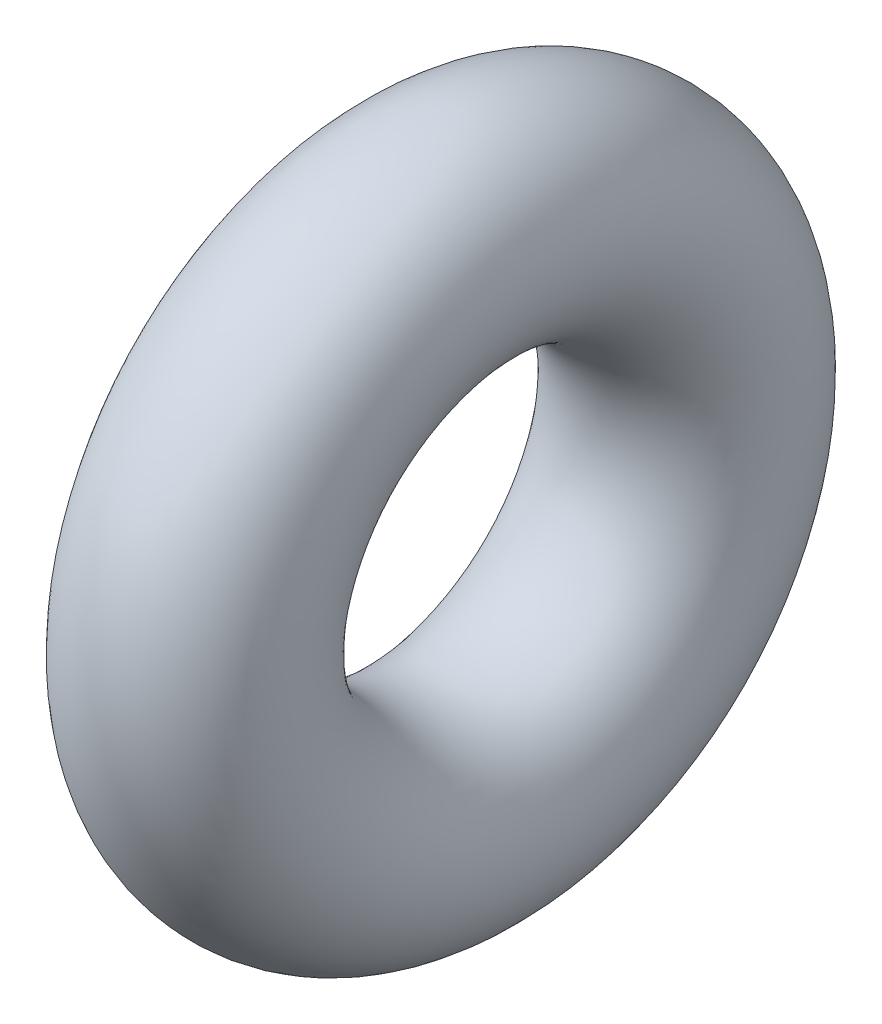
SolidWorks part; units mm, degrees
ref_plane "Front" through (0, 0, 0) normal (0, 0, 1) x (1, 0, 0)
ref_plane "Top" through (0, 0, 0) normal (0, 1, 0) x (1, 0, 0)
ref_plane "Right" through (0, 0, 0) normal (1, 0, 0) x (0, 0, -1)
sketch "Sketch1" plane through (0, 0, 0) normal (0, 0, 1) x (1, 0, 0)
  line L0 (0, 0) -> (-7.4041, 0) construction
  circle A0 centre (0, 4.1275) radius 1.7653
  dimension "D1" = 3.5306
  dimension "D2" = 4.1275
  dimension "D4" = 1.7653
  dimension "D3" = 2.3622
revolve "Revolve1" add sketch "Sketch1" angle 360 about L0
